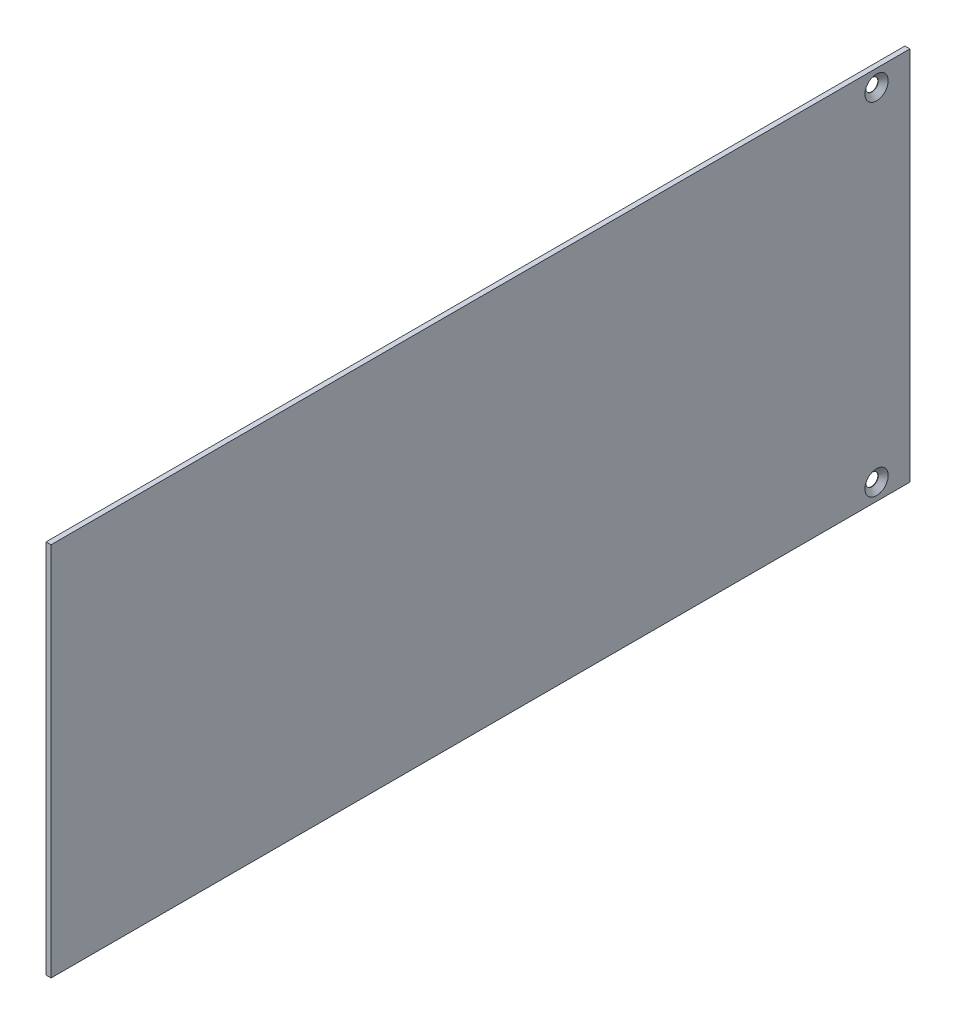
SolidWorks part; units mm, degrees
ref_plane "Front Plane" through (0, 0, 0) normal (0, 0, 1) x (1, 0, 0)
ref_plane "Top Plane" through (0, 0, 0) normal (0, 1, 0) x (1, 0, 0)
ref_plane "Right Plane" through (0, 0, 0) normal (1, 0, 0) x (0, 0, -1)
sketch "Sketch1" plane through (0, 0, 0) normal (0, 0, 1) x (1, 0, 0)
  line L0 (0, 0) -> (4.2298, 0) construction
  line L1 (-1.524, 57.15) -> (0, 57.15)
  line L2 (-1.524, 57.15) -> (-1.524, -57.15)
  line L3 (-1.524, -57.15) -> (0, -57.15)
  line L4 (0, 57.15) -> (0, -57.15)
  point P6 (0, 0)
  dimension "D1" = 114.3
  dimension "D3" = 1.524
extrude "Boss-Extrude1" add sketch "Sketch1" along normal mid plane 261.62
ref_plane "Plane1" through (0, 0, 0) normal (0, -1, 0) x (1, 0, 0)
sketch "Sketch2" plane through (0, 0, 0) normal (1, 0, 0) x (0, 0, -1)
  line L0 (120.65, 52.07) -> (120.65, -52.07) construction
  line L1 (130.81, 0) -> (158.8899, 0) construction
  line L2 (130.81, -57.15) -> (130.81, 57.15) construction
  point P7 (120.65, 0)
  dimension "D1" = 104.14
  dimension "D2" = 10.16
hole_wizard "CSK for #6 Flat Head Machine Screw (100)1" positions "Sketch4" profile "Sketch3" countersink size "#6" standard "Ansi Inch"
sketch "Sketch4" plane through (0, 0, 0) normal (1, 0, 0) x (0, 0, -1)
  point P0 (120.65, 52.07)
  point P1 (120.65, -52.07)
sketch "Sketch3" plane through (0, 52.07, -120.65) normal (0, 1, 0) x (0, 0, -1)
  line L0 (0, 0) -> (0, 1.524)
  line L1 (0, 1.524) -> (1.8986, 1.524)
  line L2 (1.8986, 1.524) -> (1.8986, 1.38)
  line L3 (1.8986, 1.38) -> (3.5433, 0)
  line L5 (3.5433, 0) -> (0, 0)
  line L6 (-1.8986, 1.38) -> (-3.5433, 0) construction
  line L11 (0, -6.35) -> (0, 107.95) construction
  dimension "Thru Hole Dia." = 3.7973
  dimension "Thru Hole Depth" = 1.524
  dimension "Near C'Sink Dia." = 7.0866
  dimension "Near C'Sink Angle" = 100
